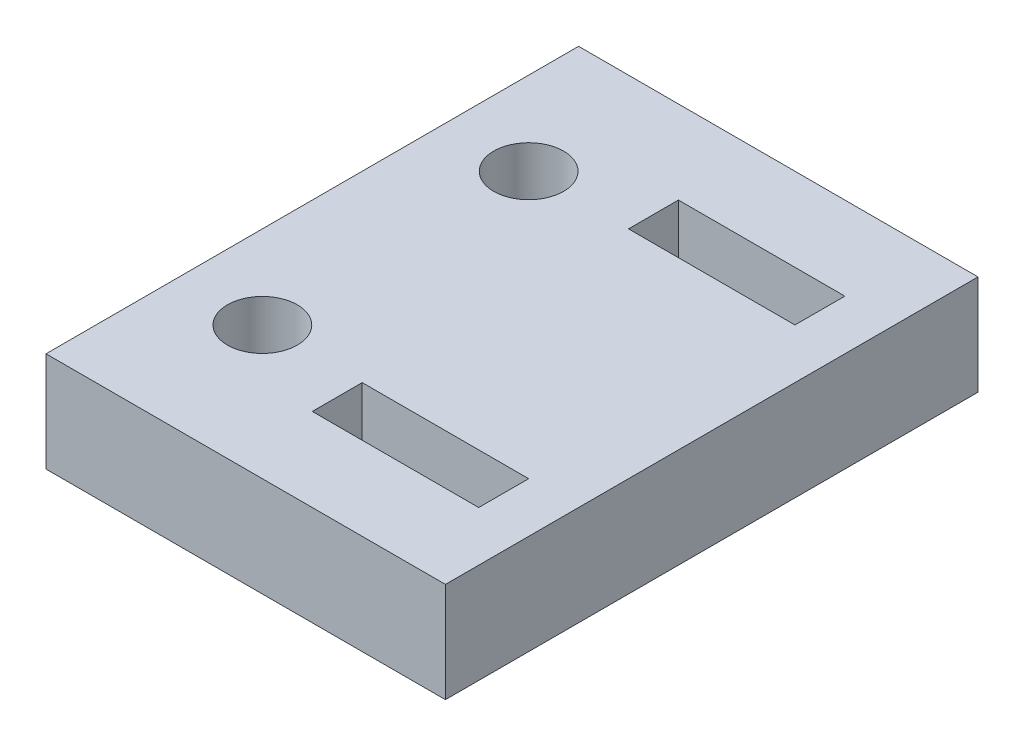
SolidWorks part; units mm, degrees
ref_plane "Спереди" through (0, 0, 0) normal (0, 0, 1) x (1, 0, 0)
ref_plane "Сверху" through (0, 0, 0) normal (0, 1, 0) x (1, 0, 0)
ref_plane "Справа" through (0, 0, 0) normal (1, 0, 0) x (0, 0, -1)
sketch "Эскиз1" plane through (0, 0, 0) normal (0, 1, 0) x (1, 0, 0)
  line L1 (0, 0) -> (24, 0)
  line L2 (0, 0) -> (0, -32)
  line L3 (0, -32) -> (24, -32)
  line L4 (24, 0) -> (24, -32)
  line L5 (11, -5) -> (21, -5)
  line L6 (11, -5) -> (11, -8)
  line L7 (11, -8) -> (21, -8)
  line L8 (21, -5) -> (21, -8)
  line L9 (11, -24) -> (21, -24)
  line L10 (11, -24) -> (11, -27)
  line L11 (11, -27) -> (21, -27)
  line L12 (21, -24) -> (21, -27)
  circle A0 centre (5, -8) radius 2.1
  circle A1 centre (5, -24) radius 2.1
  point P17 (16, -8)
  dimension "D1" = 4.2
  dimension "D2" = 5
  dimension "D3" = 16
  dimension "D4" = 8
  dimension "D5" = 8
  dimension "D6" = 10
  dimension "D7" = 3
  dimension "D8" = 3
  dimension "D9" = 10
  dimension "D10" = 5
  dimension "D11" = 5
  dimension "D12" = 16
  dimension "D13" = 3
extrude "Бобышка-Вытянуть1" add sketch "Эскиз1" along normal blind 6
